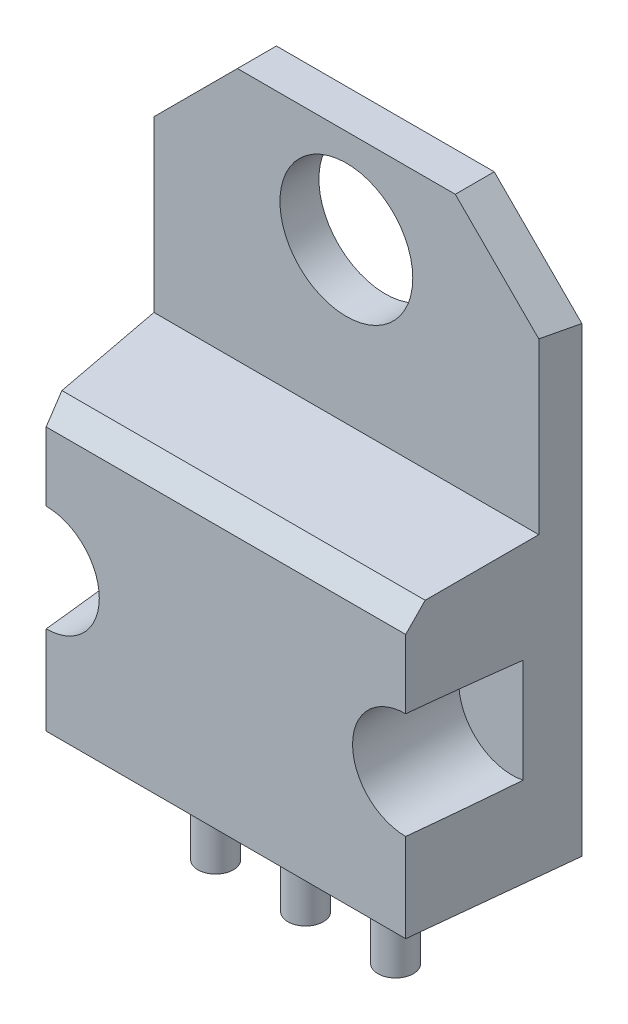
SolidWorks part; units mm, degrees
ref_plane "Face" through (0, 0, 0) normal (0, 0, 1) x (1, 0, 0)
ref_plane "Dessus" through (0, 0, 0) normal (0, 1, 0) x (1, 0, 0)
ref_plane "Droite" through (0, 0, 0) normal (1, 0, 0) x (0, 0, -1)
sketch "Esquisse1" plane through (0, 0, 0) normal (0, 0, 1) x (1, 0, 0)
  line L1 (0, 0) -> (10.15, 0)
  line L2 (0, 0) -> (0, 15.5)
  line L3 (0, 15.5) -> (10.15, 15.5)
  line L4 (10.15, 0) -> (10.15, 15.5)
  dimension "D1" = 10.15
  dimension "D2" = 15.5
extrude "Extrusion1" add sketch "Esquisse1" along normal blind 1.1
sketch "Esquisse2" plane through (0, 0, 1.1) normal (0, 0, 1) x (1, 0, 0)
  line L0 (5.075, 15.5) -> (5.075, 0) construction
  line L1 (10.15, 15.5) -> (0, 15.5) construction
  line L2 (0, 0) -> (10.15, 0) construction
  circle A0 centre (5.075, 12.85) radius 1.875
  dimension "D1" = 3.75
  dimension "D2" = 2.65
extrude "Enlèv. mat.-Extru.1" cut sketch "Esquisse2" against normal through all
chamfer "Chanfrein1" distance 2 angle 45 2 edges at (10.15, 15.5, 0.55) (0, 15.5, 0.55)
sketch "Esquisse3" plane through (0, 0, 1.1) normal (0, 0, 1) x (1, 0, 0)
  line L0 (10.15, 0) -> (10.15, 13.5) construction
  line L1 (0, 0) -> (10.15, 0)
  line L2 (0, 0) -> (0, 8)
  line L3 (0, 8) -> (10.15, 8)
  line L4 (10.15, 0) -> (10.15, 8)
  dimension "D1" = 8
extrude "Extrusion2" add sketch "Esquisse3" along normal blind 3.4
sketch "Esquisse4" plane through (0, 0, 4.5) normal (0, 0, 1) x (1, 0, 0)
  line L0 (0, 8) -> (0, 0) construction
  line L1 (10.15, 0) -> (10.15, 8) construction
  circle A0 centre (0, 4) radius 1.5
  circle A1 centre (10.15, 4) radius 1.5
  dimension "D1" = 3
extrude "Enlèv. mat.-Extru.2" cut sketch "Esquisse4" against normal blind 3
draft "Dépouille1" type of draft neutral plane draft angle 6 faces to draft 3 parameters "D1"=6
chamfer "Chanfrein2" distance 0.5 angle 45 1 edges at (5.075, 8, 4.5)
sketch "Esquisse5" plane through (0, 0, 0) normal (0, -1, 0) x (1, 0, 0)
  line L0 (10.3865, 2.25) -> (-0.2365, 2.25) construction
  line L1 (10.15, 4.5) -> (10.623, 0) construction
  line L2 (0, 4.5) -> (-0.473, 0) construction
  line L3 (5.075, 4.5) -> (5.075, 0) construction
  line L4 (0, 4.5) -> (10.15, 4.5) construction
  line L5 (-0.473, 0) -> (10.623, 0) construction
  circle A0 centre (5.075, 2.25) radius 0.5
  circle A1 centre (7.615, 2.25) radius 0.5
  circle A2 centre (2.535, 2.25) radius 0.5
  dimension "D1" = 1
  dimension "D2" = 2.54
extrude "Extrusion3" add sketch "Esquisse5" along normal blind 3
